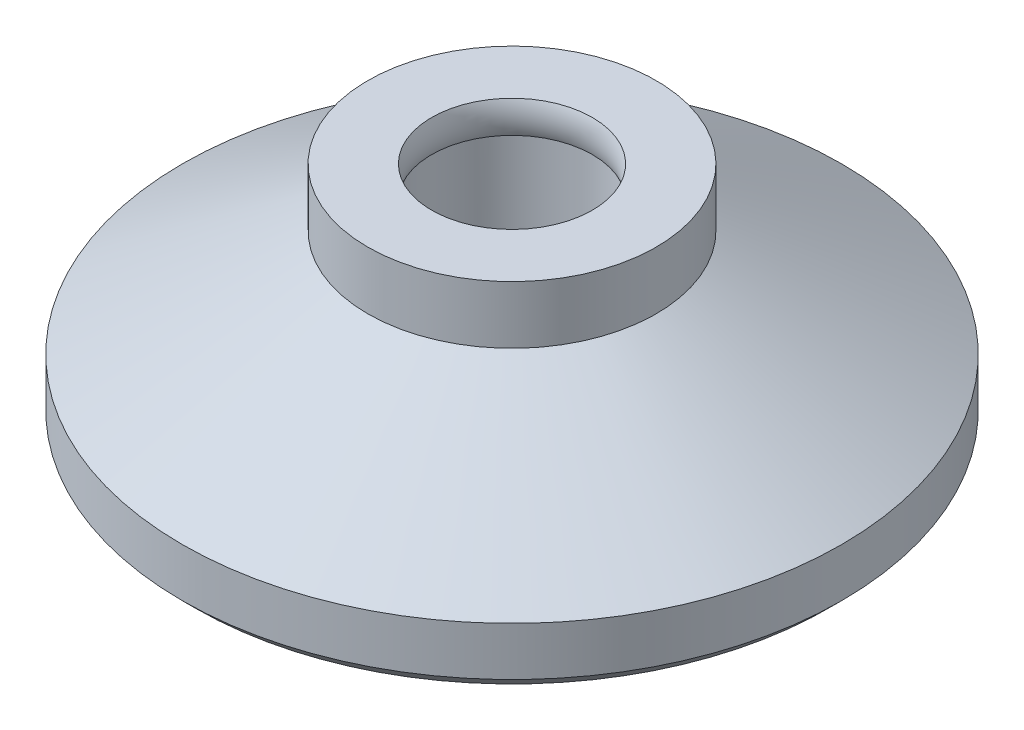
SolidWorks part; units mm, degrees
ref_plane "Front Plane" through (0, 0, 0) normal (0, 0, 1) x (1, 0, 0)
ref_plane "Top Plane" through (0, 0, 0) normal (0, 1, 0) x (1, 0, 0)
ref_plane "Right Plane" through (0, 0, 0) normal (1, 0, 0) x (0, 0, -1)
sketch "Sketch1" plane through (0, 0, 0) normal (0, 1, 0) x (1, 0, 0)
  circle A0 centre (0, 0) radius 7
  dimension "D1" = 14
extrude "Extrude1" add sketch "Sketch1" along normal mid plane 11
sketch "Sketch3" plane through (0, -5.5, 0) normal (0, -1, 0) x (1, 0, 0)
  circle A0 centre (0, 0) radius 16
  dimension "D1" = 32
extrude "Extrude2" add sketch "Sketch3" against normal blind 3
sketch "Sketch4" plane through (0, 0, 0) normal (0, 0, 1) x (1, 0, 0)
  line L0 (-16, -2.5) -> (-7, 2.6962)
  line L1 (-7, 5.5) -> (-7, -2.5) construction
  line L2 (-7, 2.6962) -> (-7, -2.5)
  line L3 (-7, -2.5) -> (-16, -2.5)
  dimension "D1" = 30
revolve "Revolve1" add sketch "Sketch4" angle 360 about axis through (0, 5.5, 0) along (0, -1, 0)
chamfer "Chamfer1" distance 0.64 angle 45 1 edges at (0, -5.5, -16)
sketch "Sketch5" plane through (0, 0, 0) normal (0, 0, 1) x (1, 0, 0)
  line L1 (0, 0) -> (0, 11.3083) construction
  line L2 (0, 5.5) -> (3.9, 5.5)
  line L3 (7, 5.5) -> (-7, 5.5) construction
  line L4 (3.9, 3.94) -> (3.9, -0.2483)
  line L5 (3.9, -0.2483) -> (0, -2.5)
  line L6 (0, -2.5) -> (0, 5.5)
  line L7 (16, -2.5) -> (-16, -2.5) construction
  arc A0 (3.9, 5.5) -> (3.9, 3.94) centre (5.772, 4.72) ccw
  point P14 (3.744, 4.72)
  dimension "D2" = 7.8
  dimension "D1" = 60
  dimension "D3" = 1.56
  dimension "D4" = 0.156
revolve "Cut-Revolve1" cut sketch "Sketch5" angle 360 about L1
equation "\"D3@Sketch5\" = \"D2@Sketch5\"*0.2"
equation "\"D4@Sketch5\" = \"D3@Sketch5\"*0.1"
